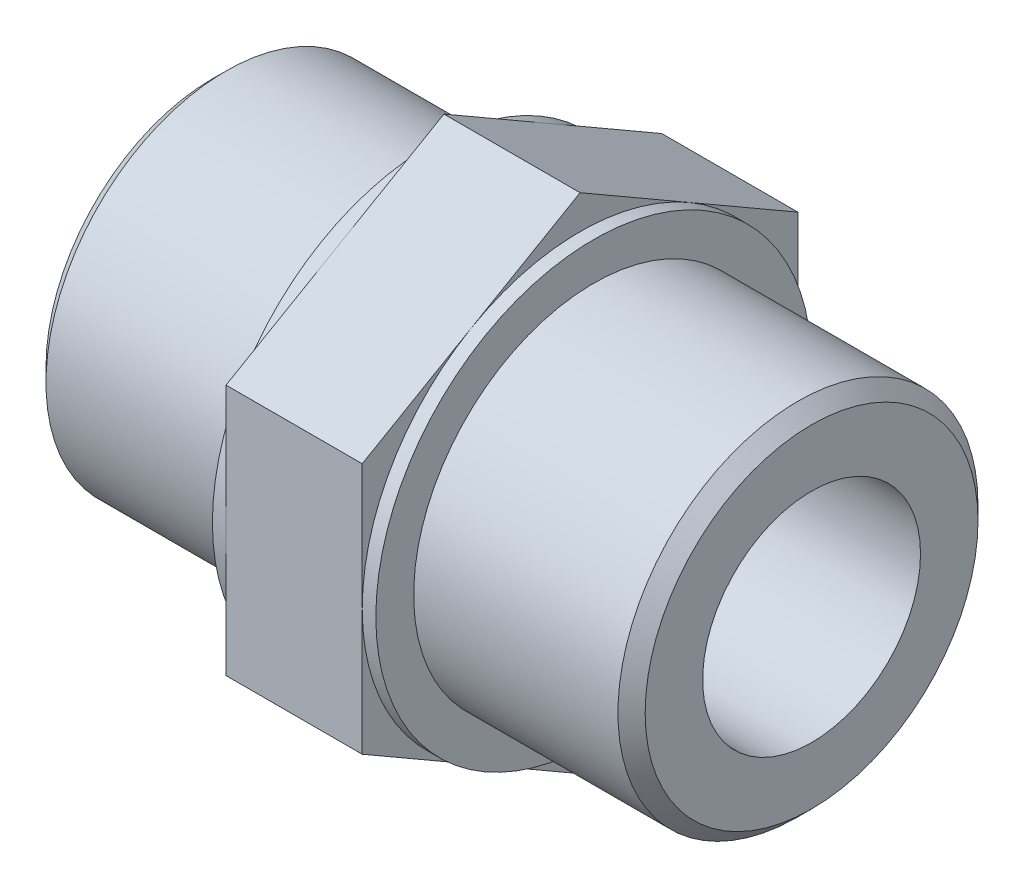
SolidWorks part; units mm, degrees
ref_plane "Face" through (0, 0, 0) normal (0, 0, 1) x (1, 0, 0)
ref_plane "Cote" through (0, 0, 0) normal (0, 1, 0) x (1, 0, 0)
ref_plane "Dessus" through (0, 0, 0) normal (1, 0, 0) x (0, 0, -1)
sketch "Esquisse1" plane through (0, 0, 0) normal (0, 0, 1) x (1, 0, 0)
  line L0 (0, 0) -> (-66.1697, 0) construction
  line L1 (-63.4444, 8) -> (-63.4444, 13.2205)
  line L2 (-63.4444, 13.2205) -> (-47.4444, 13.2205)
  line L3 (-47.4444, 13.2205) -> (-47.4444, 16)
  line L4 (-47.4444, 16) -> (-46.4444, 16)
  line L5 (-46.4444, 16) -> (-46.4444, 18.475)
  line L6 (-46.4444, 18.475) -> (-36.4444, 18.475)
  line L7 (-36.4444, 18.475) -> (-36.4444, 16)
  line L8 (-36.4444, 16) -> (-35.4444, 16)
  line L9 (-35.4444, 16) -> (-35.4444, 13.2205)
  line L10 (-35.4444, 13.2205) -> (-19.4444, 13.2205)
  line L11 (-19.4444, 13.2205) -> (-19.4444, 8)
  line L12 (-63.4444, 8) -> (-19.4444, 8)
  dimension "D1" = 26.441
  dimension "D2" = 32
  dimension "D3" = 36.95
  dimension "D4" = 16
  dimension "D5" = 17
  dimension "D6" = 44
  dimension "D7" = 16
revolve "profil" add sketch "Esquisse1" angle 360 about L0
sketch "axes" plane through (-19.4444, 0, 0) normal (1, 0, 0) x (0, 0, -1)
  line L0 (0, 21.9761) -> (0, -22.0903) construction
  line L1 (-22.8324, 0) -> (21.5766, 0) construction
sketch "Esquisse3" plane through (-36.4444, 0, 0) normal (1, 0, 0) x (0, 0, -1)
  line L1 (0, 18.4752) -> (-16, 9.2376)
  line L2 (-16, 9.2376) -> (-16, -9.2376)
  line L3 (-16, -9.2376) -> (0, -18.4752)
  line L4 (0, -18.4752) -> (16, -9.2376)
  line L5 (16, -9.2376) -> (16, 9.2376)
  line L6 (16, 9.2376) -> (0, 18.4752)
  circle A0 centre (0, 0) radius 16 construction
extrude "six pans" cut sketch "Esquisse3" against normal through all flip side to cut
chamfer "Chanfrein1" distance 1 angle 45 1 edges at (-19.4444, 0, -13.2205)
chamfer "Chanfrein2" distance 1 angle 45 1 edges at (-63.4444, 0, -13.2205)
